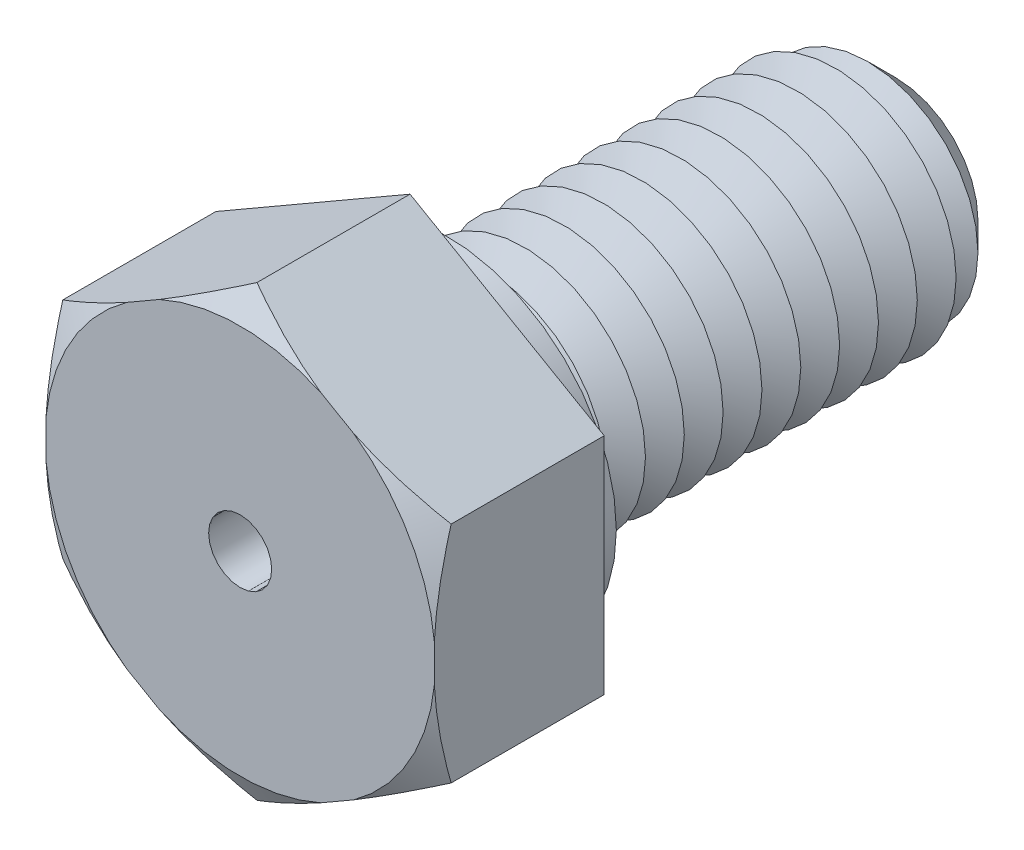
SolidWorks part; units mm, degrees
ref_plane "Front Plane" through (0, 0, 0) normal (0, 0, 1) x (1, 0, 0)
ref_plane "Top Plane" through (0, 0, 0) normal (0, 1, 0) x (1, 0, 0)
ref_plane "Right Plane" through (0, 0, 0) normal (1, 0, 0) x (0, 0, -1)
sketch "Sketch2" plane through (0, 0, 0) normal (0, 0, 1) x (1, 0, 0)
  line L1 (0, 4.6188) -> (-4, 2.3094)
  line L2 (-4, 2.3094) -> (-4, -2.3094)
  line L3 (-4, -2.3094) -> (0, -4.6188)
  line L4 (0, -4.6188) -> (4, -2.3094)
  line L5 (4, -2.3094) -> (4, 2.3094)
  line L6 (4, 2.3094) -> (0, 4.6188)
  circle A0 centre (0, 0) radius 4 construction
  dimension "D1" = 8
extrude "Boss-Extrude1" add sketch "Sketch2" along normal blind 3.5
sketch "Sketch3" plane through (0, 0, 0) normal (0, 0, -1) x (-1, 0, 0)
  circle A0 centre (0, 0) radius 2.5
  dimension "D1" = 5
extrude "Boss-Extrude2" add sketch "Sketch3" along normal blind 10
sketch "Sketch4" plane through (0, 0, 0) normal (0, 0, -1) x (-1, 0, 0)
  circle A0 centre (0, 0) radius 3.5
  dimension "D1" = 7
extrude "Boss-Extrude3" add sketch "Sketch4" along normal blind 0.75
sketch "Sketch5" plane through (0, 0, 0) normal (1, 0, 0) x (0, 0, -1)
  line L0 (-3.2117, 0) -> (6.3192, 0) construction
chamfer "Chamfer1" distance 0.8 angle 45 1 edges at (-2.5, 0, -10)
sketch "Sketch6" plane through (0, 0, 0) normal (1, 0, 0) x (0, 0, -1)
  line L0 (0.75, 2.5) -> (1.15, 1.8072)
  line L1 (1.15, 1.8072) -> (1.55, 2.5)
  line L2 (9.2, 2.5) -> (0.75, 2.5) construction
  line L3 (1.55, 2.5) -> (0.75, 2.5)
  dimension "D1" = 0.8
revolve "Cut-Revolve1" cut sketch "Sketch6" angle 360 about L0
pattern_linear "LPattern1" count 11 spacing 0.8 along (0, 0, -1) of "Cut-Revolve1"
sketch "Sketch7" plane through (0, 0, 0) normal (1, 0, 0) x (0, 0, -1)
  line L0 (-3.5, 4.6188) -> (-3.5, 4.0188)
  line L1 (-3.5, 2.3094) -> (-3.5, 4.6188) construction
  line L2 (-3.5, 4.0188) -> (-3.1536, 4.6188)
  line L3 (-3.5, 4.6188) -> (0, 4.6188) construction
  line L4 (-3.1536, 4.6188) -> (-3.5, 4.6188)
  dimension "D1" = 0.6
  dimension "D2" = 30
revolve "Cut-Revolve2" cut sketch "Sketch7" angle 360 about L0
sketch "Sketch8" plane through (0, 0, 3.5) normal (0, 0, 1) x (1, 0, 0)
  circle A0 centre (0, 0) radius 0.65
  dimension "D1" = 1.3
extrude "Cut-Extrude1" cut sketch "Sketch8" against normal up to surface (13.5 mm away)
